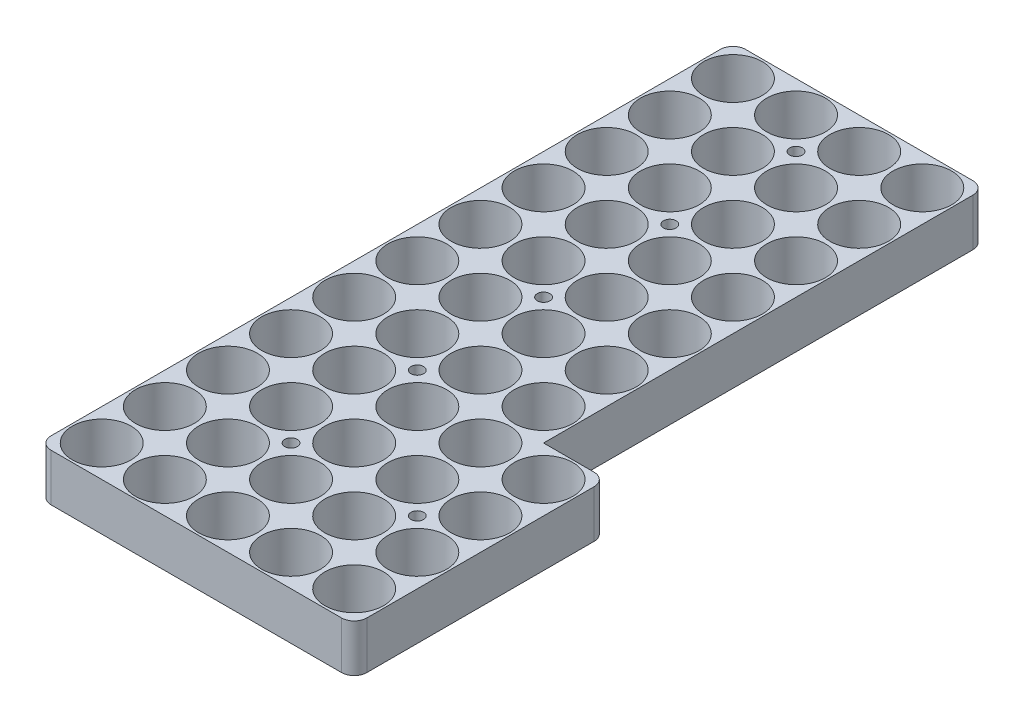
SolidWorks part; units mm, degrees
ref_plane "Plan de face" through (0, 0, 0) normal (0, 0, 1) x (1, 0, 0)
ref_plane "Plan de dessus" through (0, 0, 0) normal (0, 1, 0) x (1, 0, 0)
ref_plane "Plan de droite" through (0, 0, 0) normal (1, 0, 0) x (0, 0, -1)
sketch "Esquisse1" plane through (0, 0, 0) normal (0, 1, 0) x (1, 0, 0)
  line L0 (-60, 0) -> (60, 0) construction
  line L1 (60, 0) -> (60, 80) construction
  line L2 (60, 80) -> (40, 80) construction
  line L3 (40, 80) -> (40, 220)
  line L4 (40, 220) -> (-40, 220)
  line L5 (-40, 220) -> (-40, 80)
  line L6 (-40, 80) -> (-60, 80)
  line L7 (-60, 80) -> (-60, 0)
  line L8 (40, 80) -> (40, 0)
  line L9 (40, 0) -> (-60, 0)
  dimension "D1" = 20
  dimension "D2" = 80
  dimension "D3" = 220
  dimension "D4" = 80
extrude "Boss.-Extru.1" add sketch "Esquisse1" along normal blind 15
sketch "Esquisse2" plane through (0, 15, 0) normal (0, 1, 0) x (1, 0, 0)
  line L0 (-60, 80) -> (-60, 0) construction
  line L2 (-60, 0) -> (40, 0) construction
  circle A0 centre (-50, 10) radius 9.3
  dimension "D3" = 18.6
  dimension "D1" = 10
  dimension "D2" = 10
extrude "Enlèv. mat.-Extru.1" cut sketch "Esquisse2" against normal offset from surface (13.5 mm away) 1.5
pattern_linear "Répétition linéaire1" count 11 spacing 20 along (0, 0, -1) count 6 spacing 20 along (1, 0, 0) of "Enlèv. mat.-Extru.1"
sketch "Esquisse3" plane through (0, 15, 0) normal (0, 1, 0) x (1, 0, 0)
  line L2 (-50, 50) -> (-30, 30) construction
  circle A0 centre (-40, 40) radius 2
  circle A1 centre (-50, 50) radius 9.3 construction
  circle A3 centre (-30, 30) radius 9.3 construction
  dimension "D1" = 4
extrude "Enlèv. mat.-Extru.2" cut sketch "Esquisse3" against normal through all
pattern_linear "Répétition linéaire2" count 2 spacing 40 along (1, 0, 0) of "Enlèv. mat.-Extru.2"
pattern_linear "Répétition linéaire3" count 5 spacing 40 along (0, 0, -1) of "Répétition linéaire2"
sketch "Esquisse6" plane through (0, 0, 0) normal (0, -1, 0) x (1, 0, 0)
  line L0 (-39, -5) -> (-39, -15)
  line L1 (-39, -5) -> (39, -5)
  line L2 (-39, -15) -> (39, -15)
  line L3 (39, -5) -> (39, -15)
  line L4 (40, 0) -> (40, -220) construction
  line L5 (0, 0) -> (0, -5) construction
  line L6 (-60, 0) -> (40, 0) construction
  point P9 (-39, -10)
  dimension "D1" = 10
  dimension "D2" = 1
  dimension "D3" = 10
extrude "Enlèv. mat.-Extru.5" cut sketch "Esquisse6" against normal up to surface (1.5 mm away) contours L1 L3 L2 L0
pattern_linear "Répétition linéaire6" count 11 spacing 20 along (0, 0, -1) of "Enlèv. mat.-Extru.5"
sketch "Esquisse7" plane through (0, 0, 0) normal (0, -1, 0) x (1, 0, 0)
  line L0 (-55, -1) -> (-55, -79)
  line L1 (-55, -1) -> (-45, -1)
  line L2 (-55, -79) -> (-45, -79)
  line L3 (-45, -1) -> (-45, -79)
  line L4 (-39, -15) -> (39, -15) construction
  line L5 (-39, -5) -> (-39, -15) construction
  line L6 (-60, -80) -> (-60, 0) construction
  line L7 (-40, -80) -> (-60, -80) construction
  point P8 (-50, -79)
  dimension "D1" = 10
  dimension "D2" = 1
extrude "Enlèv. mat.-Extru.6" cut sketch "Esquisse7" against normal up to surface (1.5 mm away)
move or copy body "Corps-Déplacer/Copier1" bodies to move or copy 110
sketch "Esquisse8" plane through (0, 0, 0) normal (0, -1, 0) x (1, 0, 0)
  line L0 (-37.8416, -15) -> (-25, -17.8416)
  line L1 (-25, -17.8416) -> (-25, -22.1584)
  line L2 (-25, -22.1584) -> (-37.8416, -25)
  line L3 (-37.8416, -25) -> (-2.1584, -25)
  line L4 (-2.1584, -25) -> (-15, -22.1584)
  line L5 (-15, -22.1584) -> (-15, -17.8416)
  line L6 (-15, -17.8416) -> (-2.1584, -15)
  line L7 (-25, -20) -> (-15, -20) construction
  line L8 (-39, -5) -> (-39, -15) construction
  line L9 (-37.8416, -15) -> (-2.1584, -15)
  arc A0 (-2.1584, -15) -> (-2.1584, -5) centre (-10, -10) ccw construction
  arc A1 (-17.8416, -25) -> (-17.8416, -35) centre (-10, -30) ccw construction
  arc A2 (-22.1584, -35) -> (-22.1584, -25) centre (-30, -30) ccw construction
  arc A3 (-22.1584, -15) -> (-22.1584, -5) centre (-30, -10) ccw construction
extrude "Enlèv. mat.-Extru.7" cut sketch "Esquisse8" against normal up to surface (1.5 mm away)
pattern_linear "Répétition linéaire7" count 5 spacing 40 along (0, 0, -1) count 2 spacing 40 along (1, 0, 0) of "Enlèv. mat.-Extru.7"
fillet "Congé1" radius 4 5 edges at (-40, 7.5, 0) (-40, 7.5, -220) (40, 7.5, -220) (60, 7.5, -80) (60, 7.5, 0)
